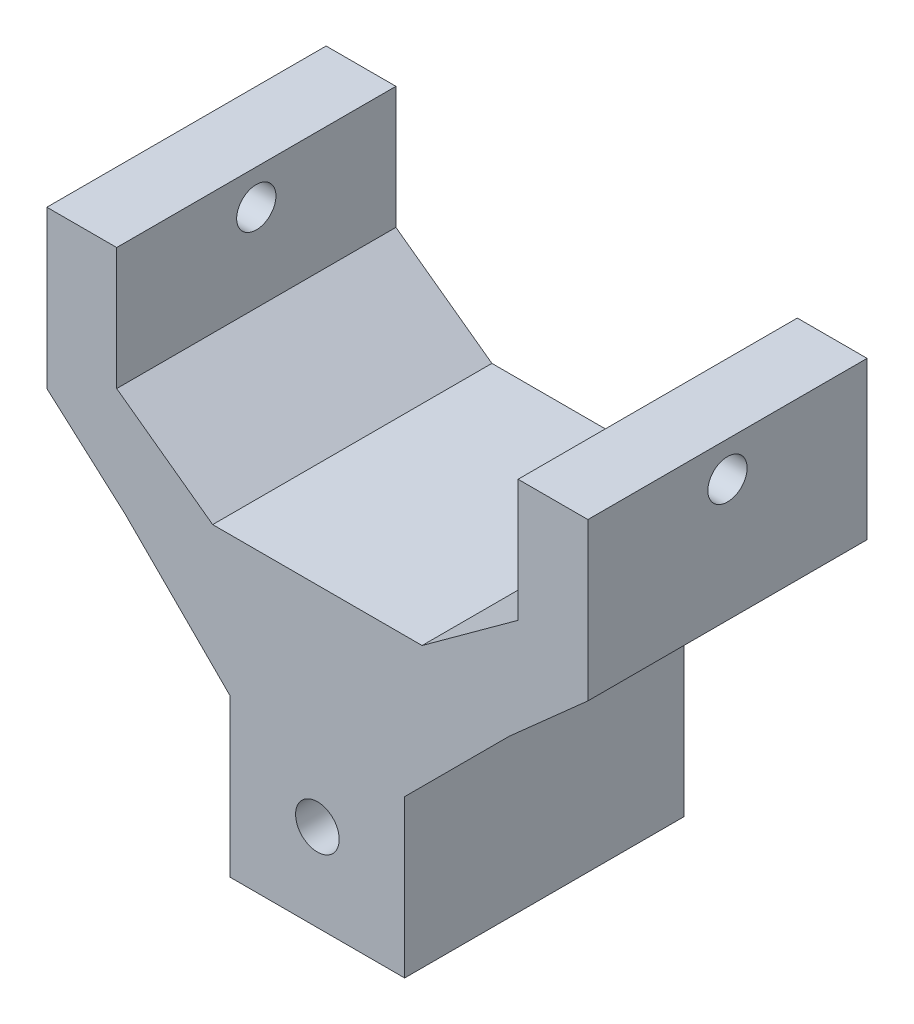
SolidWorks part; units mm, degrees
ref_plane "前视基准面" through (0, 0, 0) normal (0, 0, 1) x (1, 0, 0)
ref_plane "上视基准面" through (0, 0, 0) normal (0, 1, 0) x (1, 0, 0)
ref_plane "右视基准面" through (0, 0, 0) normal (1, 0, 0) x (0, 0, -1)
other "Configuration Table"
sketch "草图5" plane through (0, 0, 0) normal (0, 0, 1) x (1, 0, 0)
  line L0 (-10, -150) -> (10, -150)
  line L1 (10, -150) -> (10, -132)
  line L2 (10, -132) -> (22, -120)
  line L3 (22, -120) -> (31, -112)
  line L4 (31, -112) -> (31, -94)
  line L5 (31, -94) -> (23, -94)
  line L6 (23, -94) -> (23, -108)
  line L7 (23, -108) -> (12, -116)
  line L8 (12, -116) -> (-12, -116)
  line L9 (-12, -116) -> (-23, -108)
  line L10 (-23, -108) -> (-23, -94)
  line L11 (-23, -94) -> (-31, -94)
  line L12 (-31, -94) -> (-31, -112)
  line L13 (-31, -112) -> (-22, -120)
  line L14 (-22, -120) -> (-10, -132)
  line L15 (-10, -132) -> (-10, -150)
  dimension "D2" = 10
  dimension "D3" = 22
  dimension "D4" = 12
  dimension "D5" = 23
  dimension "D6" = 31
  dimension "D7" = 10
  dimension "D8" = 22
  dimension "D9" = 12
  dimension "D10" = 31
  dimension "D11" = 94
  dimension "D12" = 108
  dimension "D13" = 112
  dimension "D14" = 116
  dimension "D15" = 120
  dimension "D16" = 150
extrude "Arm_End_U_Adapter" add sketch "草图5" against normal mid plane 32
sketch "草图6" plane through (0, 0, 0) normal (0, 0, 1) x (1, 0, 0)
  circle A0 centre (0, -140) radius 2.5
  dimension "D1" = 5
  dimension "D2" = 140
extrude "Arm_End_Pin_D5" cut sketch "草图6" against normal mid plane 500
sketch "草图7" plane through (0, 0, 0) normal (1, 0, 0) x (0, 0, -1)
  circle A0 centre (0, -98) radius 2.25
  dimension "D1" = 4.5
  dimension "D2" = 98
extrude "Stator_Side_Screw_Clearance_D4_5" cut sketch "草图7" against normal mid plane 500
